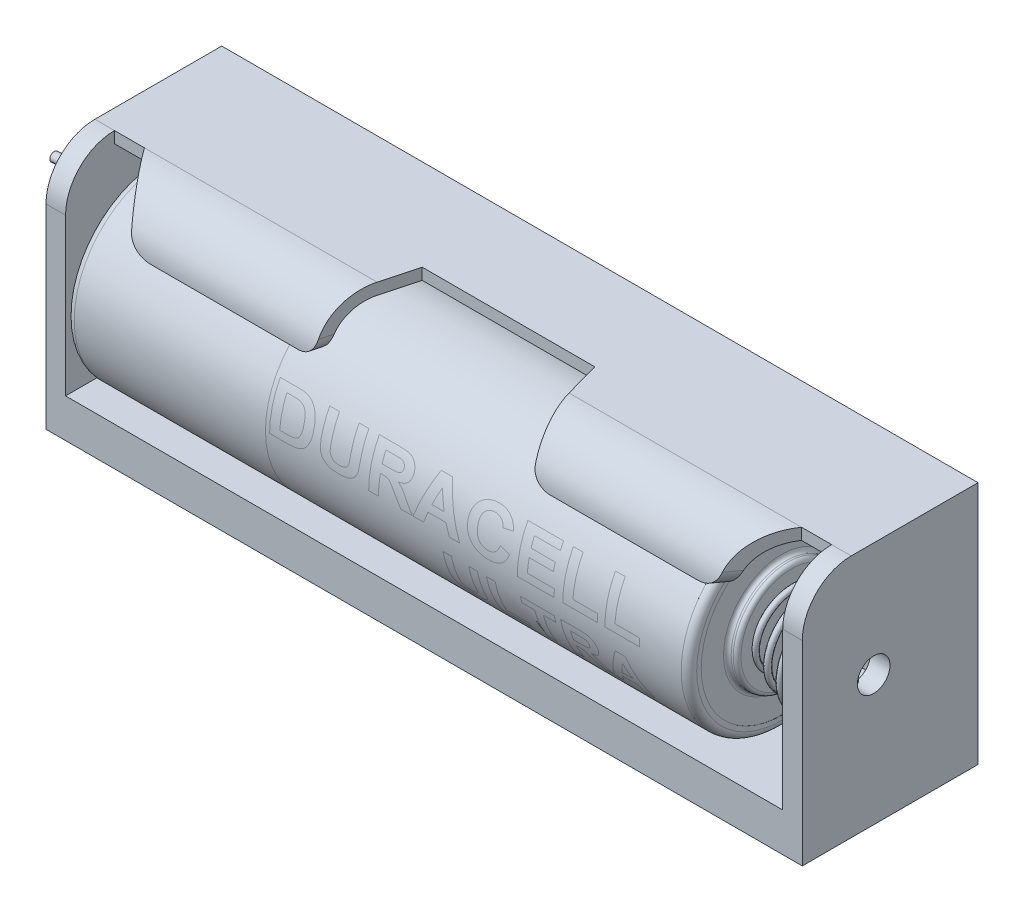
SolidWorks part; units mm, degrees
ref_plane "Front Plane" through (0, 0, 0) normal (0, 0, 1) x (1, 0, 0)
ref_plane "Top Plane" through (0, 0, 0) normal (0, 1, 0) x (1, 0, 0)
ref_plane "Right Plane" through (0, 0, 0) normal (1, 0, 0) x (0, 0, -1)
imported_body "Imported30"
imported_body "Imported31"
imported_body "Imported32"
imported_body "Imported33"
imported_body "Imported34"
imported_body "Imported35"
imported_body "Imported36"
imported_body "Surface-Imported60"
sketch "Sketch1" plane through (0, 0, 13.6906) normal (0, 0, 1) x (1, 0, 0)
  line L0 (-29.464, 12.7) -> (-29.464, -12.7) construction
  line L1 (-29.464, -0.508) -> (29.464, -0.508)
  line L2 (-29.464, -0.508) -> (-29.464, -16.51)
  line L3 (-29.464, -16.51) -> (29.464, -16.51)
  line L4 (29.464, -0.508) -> (29.464, -16.51)
  line L5 (29.464, -16.51) -> (29.464, -12.7) construction
extrude "Extrude1" cut sketch "Sketch1" against normal mid plane 40
sketch "Sketch2" plane through (0, -0.508, 0) normal (0, -1, 0) x (1, 0, 0)
  line L1 (-29.464, 13.6906) -> (29.464, 13.6906)
  line L2 (-29.464, 13.6906) -> (-29.464, 0)
  line L3 (-29.464, 0) -> (29.464, 0)
  line L4 (29.464, 13.6906) -> (29.464, 0)
extrude "Extrude2" add sketch "Sketch2" along normal blind 2
sketch "Sketch4" plane through (0, 0, 0) normal (0, 0, 1) x (1, 0, 0)
  line L1 (-92.0279, 16.4327) -> (-42.169, 16.4327)
  line L2 (-92.0279, 16.4327) -> (-92.0279, -12.0221)
  line L3 (-92.0279, -12.0221) -> (-42.169, -12.0221)
  line L4 (-42.169, 16.4327) -> (-42.169, -12.0221)
extrude "Cut-Extrude1" cut sketch "Sketch4" against normal mid plane 10
